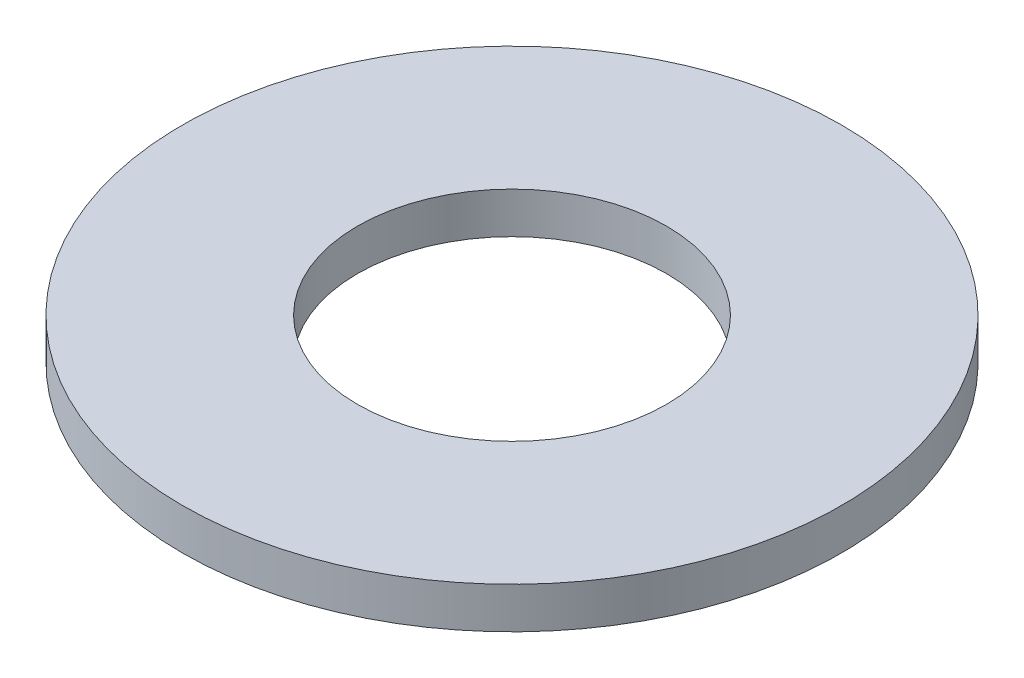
SolidWorks part; units mm, degrees
ref_plane "Front Plane" through (0, 0, 0) normal (0, 0, 1) x (1, 0, 0)
ref_plane "Top Plane" through (0, 0, 0) normal (0, 1, 0) x (1, 0, 0)
ref_plane "Right Plane" through (0, 0, 0) normal (1, 0, 0) x (0, 0, -1)
sketch "Sketch1" plane through (0, 0, 0) normal (0, 1, 0) x (1, 0, 0)
  circle A0 centre (0, 0) radius 50.8
  dimension "D1" = 101.6
extrude "Extrude1" add sketch "Sketch1" along normal blind 6.35
sketch "Sketch2" plane through (0, 6.35, 0) normal (0, 1, 0) x (1, 0, 0)
  circle A0 centre (0, 0) radius 23.8125
  dimension "D1" = 47.625
extrude "Cut-Extrude1" cut sketch "Sketch2" against normal blind 6.35
